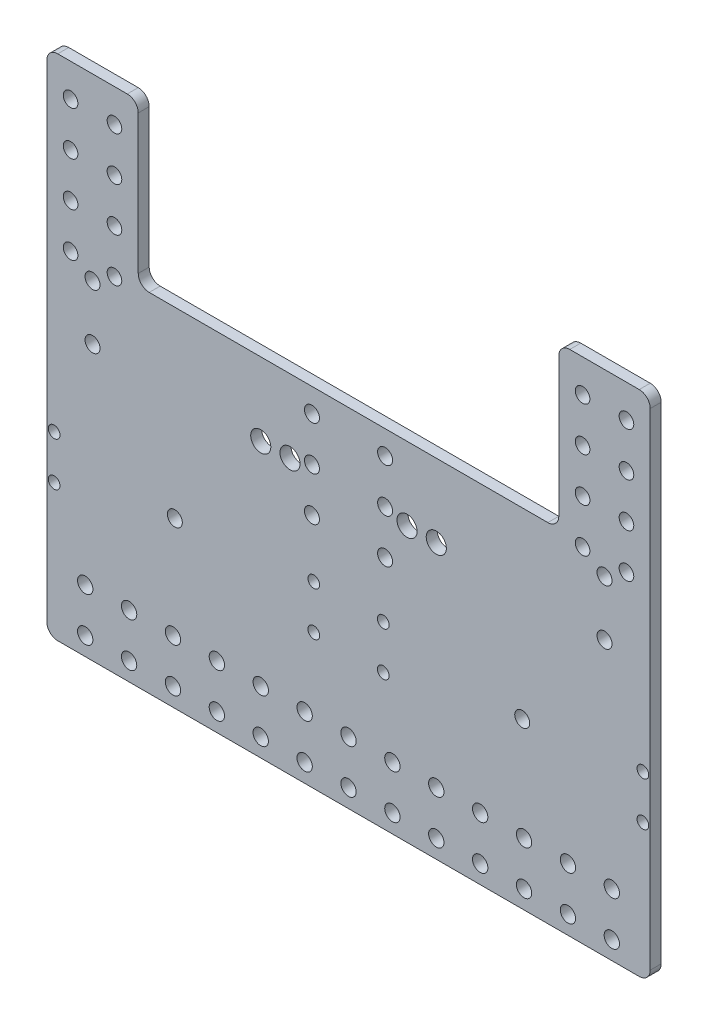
SolidWorks part; units mm, degrees
ref_plane "前视基准面" through (0, 0, 0) normal (0, 0, 1) x (1, 0, 0)
ref_plane "上视基准面" through (0, 0, 0) normal (0, 1, 0) x (1, 0, 0)
ref_plane "右视基准面" through (0, 0, 0) normal (1, 0, 0) x (0, 0, -1)
sketch "草图1" plane through (0, 0, 0) normal (0, 0, 1) x (1, 0, 0)
  line L0 (-421.3386, 0) -> (441.7259, 0) construction
  line L1 (0, 427.568) -> (0, -457.0164) construction
  line L2 (-70, 224.7956) -> (-70, 182.655) construction
  line L3 (-82.5, -215) -> (82.5, -215)
  line L4 (-82.5, -215) -> (-82.5, 215)
  line L5 (-82.5, 215) -> (82.5, 215)
  line L6 (82.5, -215) -> (82.5, 215)
  line L7 (-82.5, -215) -> (82.5, 215) construction
  line L8 (-82.5, 215) -> (82.5, -215) construction
  line L9 (-98.7333, 200) -> (-47.9143, 200) construction
  circle A0 centre (-70, 200) radius 2.05
  circle A1 centre (-70, 185) radius 2.05
  circle A2 centre (70, 185) radius 2.05
  circle A3 centre (70, 200) radius 2.05
  circle A4 centre (-70, -185) radius 2.05
  circle A5 centre (-70, -200) radius 2.05
  circle A6 centre (70, -200) radius 2.05
  circle A7 centre (70, -185) radius 2.05
  point P5 (0, 0)
  dimension "D5" = 4.1
  dimension "D6" = 4.1
  dimension "D7" = 15
  dimension "D1" = 165
  dimension "D2" = 430
  dimension "D3" = 15
  dimension "D4" = 12.5
  dimension "D8" = 0
extrude "凸台-拉伸1" add sketch "草图1" along normal blind 3
sketch "草图2" plane through (0, 0, 3) normal (0, 0, 1) x (1, 0, 0)
  line L0 (0, 347.0549) -> (0, -401.2293) construction
  line L1 (-360.8481, 0) -> (355.8343, 0) construction
  line L2 (-43.4458, -43.4458) -> (0, 0) construction
  circle A0 centre (0, 0) radius 29.5 construction
  circle A1 centre (-20.8597, -20.8597) radius 1.6
  circle A2 centre (-20.8597, 20.8597) radius 1.6
  circle A3 centre (20.8597, 20.8597) radius 1.6
  circle A4 centre (20.8597, -20.8597) radius 1.6
  point P19 (0, 0)
  dimension "D1" = 59
  dimension "D3" = 3.2
  dimension "D5" = 20.8597
  dimension "D6" = 20.8597
  dimension "D2" = 45
  dimension "D4" = 4
extrude "切除-拉伸1" cut sketch "草图2" against normal through all both and the other way through all
sketch "草图6" plane through (0, 0, 0) normal (0, 0, -1) x (-1, 0, 0)
  line L0 (-227.0694, 0) -> (202.0465, 0) construction
  line L1 (0, 619.2168) -> (0, -760.7029) construction
  line L2 (-82.5, -215) -> (-82.5, -285)
  line L3 (-82.5, 215) -> (82.5, 215)
  line L4 (-82.5, 215) -> (-82.5, -215)
  line L5 (-82.5, -215) -> (82.5, -215)
  line L6 (82.5, 215) -> (82.5, -215)
  line L7 (-160, 90) -> (160, 90)
  line L8 (-160, 90) -> (-160, -90)
  line L9 (-160, -90) -> (160, -90)
  line L10 (160, 90) -> (160, -90)
  line L11 (-160, 90) -> (160, -90) construction
  line L12 (-160, -90) -> (160, 90) construction
  line L13 (-82.5, -285) -> (-225, -285)
  line L14 (-225, -285) -> (-225, -325)
  line L15 (-225, -325) -> (225, -325)
  line L16 (225, -285) -> (225, -325)
  line L17 (82.5, -285) -> (225, -285)
  line L18 (82.5, -215) -> (82.5, -285)
  line L19 (-82.5, 215) -> (-82.5, 225)
  line L20 (-82.5, 225) -> (-200, 267)
  line L21 (-200, 267) -> (-200, 287)
  line L22 (-200, 287) -> (200, 287)
  line L23 (200, 267) -> (200, 287)
  line L24 (82.5, 225) -> (200, 267)
  line L25 (82.5, 215) -> (82.5, 225)
  point P11 (0, 0)
  point P21 (0, -325)
  point P28 (0, 287)
  dimension "D1" = 180
  dimension "D2" = 320
  dimension "D3" = 450
  dimension "D4" = 400
  dimension "D5" = 40
  dimension "D6" = 70
  dimension "D7" = 72
  dimension "D8" = 10
  dimension "D9" = 20
extrude "凸台-拉伸2" add sketch "草图6" against normal blind 3 contours L3 L25 L24 L23 L22 L21 L20 L19 | L8 L9 L4 L7 | L10 L7 L6 L9 | L18 L5 L2 L13 L14 L15 L16 L17
fillet "圆角1" radius 60 2 edges at (-82.5, -90, 1.5) (82.5, -90, 1.5)
fillet "圆角2" radius 20 2 edges at (82.5, 225, 1.5) (-82.5, 225, 1.5)
fillet "圆角3" radius 10 8 edges at (200, 267, 1.5) (-200, 267, 1.5) (-200, 287, 1.5) (200, 287, 1.5) (-225, -325, 1.5) (-225, -285, 1.5) (225, -325, 1.5) (225, -285, 1.5)
sketch "草图9" plane through (0, 0, 0) normal (0, 0, -1) x (-1, 0, 0)
  line L0 (0, 378.7393) -> (0, -366.1079) construction
  line L1 (453.619, 0) -> (-417.8729, 0) construction
  circle A0 centre (9, 169) radius 1.6
  circle A1 centre (-9, 169) radius 1.6
  circle A2 centre (-9, -169) radius 1.6
  circle A3 centre (9, -169) radius 1.6
  circle A4 centre (-119, 9) radius 1.6
  circle A5 centre (-119, -9) radius 1.6
  circle A6 centre (119, -9) radius 1.6
  circle A7 centre (119, 9) radius 1.6
  dimension "D1" = 3.2
  dimension "D2" = 9
  dimension "D3" = 338
  dimension "D4" = 3.2
  dimension "D5" = 9
  dimension "D6" = 119
extrude "切除-拉伸6" cut sketch "草图9" against normal through all both and the other way through all
sketch "草图10" plane through (0, 0, 0) normal (0, 0, -1) x (-1, 0, 0)
  line L0 (0, 401.4987) -> (0, -411.1621) construction
  line L1 (-190, 287) -> (190, 287) construction
  circle A0 centre (-32.5, 252) radius 1.6
  circle A1 centre (42.5, 252) radius 1.6
  circle A2 centre (-32.5, 230) radius 1.6
  circle A3 centre (42.5, 230) radius 1.6
  dimension "D1" = 3.2
  dimension "D2" = 35
  dimension "D3" = 32.5
  dimension "D5" = 32.5
  dimension "D6" = 22
  dimension "D4" = 2
  dimension "D7" = 2
extrude "切除-拉伸7" cut sketch "草图10" against normal through all both and the other way through all
sketch "草图11" plane through (0, 0, 0) normal (0, 0, -1) x (-1, 0, 0)
  line L0 (-240.8833, 0) -> (241.6194, 0) construction
  line L1 (-70, 400.9007) -> (-70, -322.8007) construction
  line L2 (-60, 13.8882) -> (-60, -20.7957) construction
  line L3 (0, -540.0334) -> (0, 534.218) construction
  line L4 (60, 13.8882) -> (60, -20.7957) construction
  circle A0 centre (-67.5, 7.5) radius 1.6
  circle A1 centre (-52.5, 7.5) radius 1.6
  circle A2 centre (-52.5, -7.5) radius 1.6
  circle A3 centre (-67.5, -7.5) radius 1.6
  circle A4 centre (67.5, -7.5) radius 1.6
  circle A5 centre (52.5, -7.5) radius 1.6
  circle A6 centre (52.5, 7.5) radius 1.6
  circle A7 centre (67.5, 7.5) radius 1.6
  dimension "D3" = 3.2
  dimension "D4" = 7.5
  dimension "D5" = 7.5
  dimension "D1" = 70
  dimension "D2" = 10
extrude "切除-拉伸8" cut sketch "草图11" against normal through all both and the other way through all
sketch "草图12" plane through (0, 0, 0) normal (0, 0, -1) x (-1, 0, 0)
  line L0 (-297.0189, 0) -> (244.4648, 0) construction
  line L1 (0, 398.3573) -> (0, -359.0878) construction
  line L2 (-160, 90) -> (-160, -90) construction
  circle A0 centre (-120, 35.79) radius 1.6
  circle A1 centre (-120, -35.79) radius 1.6
  circle A2 centre (-91.55, 35.79) radius 1.6
  circle A3 centre (-91.55, -35.79) radius 1.6
  dimension "D1" = 3.2
  dimension "D2" = 35.79
  dimension "D4" = 40
  dimension "D5" = 28.45
  dimension "D6" = 35.79
  dimension "D3" = 2
extrude "切除-拉伸9" [suppressed] cut sketch "草图12" against normal through all both and the other way through all
fillet "圆角4" radius 30 4 edges at (160, -90, 1.5) (160, 90, 1.5) (-160, -90, 1.5) (-160, 90, 1.5)
sketch "草图13" plane through (0, 0, 3) normal (0, 0, 1) x (1, 0, 0)
  line L0 (-277.8952, 0) -> (259.9137, 0) construction
  line L1 (0, 338.1615) -> (0, -323.8829) construction
  line L2 (0, 55) -> (0, 85) construction
  line L3 (-98.826, 70) -> (91.3151, 70) construction
  circle A0 centre (0, 70) radius 12.5
  circle A1 centre (9, 169) radius 1.6 construction
  circle A4 centre (-20, 70) radius 2.1
  circle A5 centre (20, 70) radius 2.1
  point P7 (0, 70)
  dimension "D6" = 25
  dimension "D7" = 99
  dimension "D8" = 4.2
  dimension "D9" = 20
  dimension "D3" = 70
extrude "切除-拉伸10" cut sketch "草图13" against normal through all both and the other way through all
sketch "草图14" plane through (0, 0, 3) normal (0, 0, 1) x (1, 0, 0)
  line L0 (0, 413.2292) -> (0, -453.9607) construction
  line L1 (-225.2126, 0) -> (210.9363, 0) construction
  line L2 (97.5, 10) -> (97.5, -10) construction
  line L3 (-82.5, 150) -> (82.5, 150) construction
  line L4 (-82.5, 150) -> (-82.5, -150) construction
  line L5 (-82.5, -150) -> (82.5, -150) construction
  line L6 (82.5, 150) -> (82.5, -150) construction
  line L7 (105.5, 10) -> (105.5, -10)
  line L8 (89.5, 10) -> (89.5, -10)
  line L9 (-97.5, 10) -> (-97.5, -10) construction
  line L10 (-105.5, 10) -> (-105.5, -10)
  line L11 (-89.5, 10) -> (-89.5, -10)
  arc A0 (105.5, 10) -> (89.5, 10) centre (97.5, 10) ccw
  arc A1 (89.5, -10) -> (105.5, -10) centre (97.5, -10) ccw
  arc A2 (-105.5, 10) -> (-89.5, 10) centre (-97.5, 10) cw
  arc A3 (-89.5, -10) -> (-105.5, -10) centre (-97.5, -10) cw
  point P13 (97.5, 0)
  point P20 (-97.5, 0)
  dimension "D1" = 8
  dimension "D2" = 20
  dimension "D3" = 15
extrude "切除-拉伸11" cut sketch "草图14" against normal through all both and the other way through all
sketch "草图15" plane through (0, 0, 3) normal (0, 0, 1) x (1, 0, 0)
  line L0 (0, 338.1615) -> (0, -332.0563) construction
  line L1 (-295.0593, 0) -> (246.8363, 0) construction
  line L2 (-160, 60) -> (-160, -60.8723) construction
  circle A0 centre (-140, 39.5) radius 1.6
  circle A1 centre (-98, 39.5) radius 1.6
  circle A2 centre (-98, -39.5) radius 1.6
  circle A3 centre (-140, -39.5) radius 1.6
  dimension "D1" = 3.2
  dimension "D2" = 39.5
  dimension "D4" = 20
  dimension "D5" = 39.5
  dimension "D6" = 42
  dimension "D3" = 2
extrude "切除-拉伸12" [suppressed] cut sketch "草图15" against normal through all both and the other way through all
sketch "草图16" plane through (0, 0, 3) normal (0, 0, 1) x (1, 0, 0)
  line L0 (0, 287) -> (0, 0) construction
  line L1 (190, 287) -> (-190, 287) construction
  line L2 (215, -325) -> (-215, -325) construction
  circle A0 centre (-45, -75) radius 1.55
  circle A1 centre (45, -75) radius 1.55
  circle A2 centre (45, -175) radius 1.55
  circle A3 centre (-45, -175) radius 1.55
  dimension "D1" = 3.1
  dimension "D2" = 90
  dimension "D3" = 2
  dimension "D5" = 150
  dimension "D4" = 2
extrude "切除-拉伸13" cut sketch "草图16" against normal blind 10
sketch "草图17" plane through (0, 0, 3) normal (0, 0, 1) x (1, 0, 0)
  line L0 (0, 287) -> (0, -367.0095) construction
  line L1 (190, 287) -> (-190, 287) construction
  line L2 (215, -325) -> (-215, -325) construction
  line L3 (-160, -0.4361) -> (160, -0.4361) construction
  line L4 (-160, 60) -> (-160, -60.8723) construction
  line L5 (160, 60) -> (160, -60.8723) construction
  circle A0 centre (-25, 217) radius 1.55
  circle A1 centre (25, 217) radius 1.55
  circle A2 centre (25, 167) radius 1.55
  circle A3 centre (-25, 167) radius 1.55
  circle A4 centre (-47.5, -265) radius 2.05
  circle A5 centre (47.5, -265) radius 2.05
  circle A6 centre (47.5, -240) radius 2.05
  circle A7 centre (-47.5, -240) radius 2.05
  circle A8 centre (-150, 47.0639) radius 2.05
  circle A9 centre (-125, 47.0639) radius 2.05
  circle A10 centre (-125, -47.9361) radius 2.05
  circle A11 centre (-150, -47.9361) radius 2.05
  circle A12 centre (125, -47.9361) radius 2.05
  circle A13 centre (150, -47.9361) radius 2.05
  circle A14 centre (150, 47.0639) radius 2.05
  circle A15 centre (125, 47.0639) radius 2.05
  circle A16 centre (-70, 185) radius 2.05 construction
  circle A18 centre (70, 175) radius 2.05
  circle A19 centre (70, 160) radius 2.05
  circle A20 centre (-70, 160) radius 2.05
  circle A21 centre (-70, 175) radius 2.05
  dimension "D1" = 3.1
  dimension "D2" = 70
  dimension "D3" = 50
  dimension "D4" = 2
  dimension "D6" = 4.1
  dimension "D7" = 95
  dimension "D8" = 60
  dimension "D9" = 2
  dimension "D11" = 95
  dimension "D12" = 4.1
  dimension "D13" = 10
  dimension "D16" = 0
  dimension "D17" = 0
  dimension "D5" = 2
  dimension "D10" = 2
  dimension "D14" = 2
  dimension "D15" = 2
extrude "切除-拉伸14" cut sketch "草图17" against normal blind 10
sketch "草图18" plane through (0, 0, 3) normal (0, 0, 1) x (1, 0, 0)
  line L0 (0, -325) -> (0, 0) construction
  line L1 (215, -325) -> (-215, -325) construction
  line L2 (-100, -325) -> (100, -325)
  line L3 (100, -325) -> (71.1325, -275)
  line L4 (71.1325, -275) -> (-71.1325, -275)
  line L5 (-100, -325) -> (-71.1325, -275)
  point P10 (0, -275)
  dimension "D1" = 200
  dimension "D2" = 50
  dimension "D3" = 60
extrude "切除-拉伸15" cut sketch "草图18" against normal blind 10
fillet "圆角5" radius 20 4 edges at (100, -325, 1.5) (71.1325, -275, 1.5) (-71.1325, -275, 1.5) (-100, -325, 1.5)
fillet "圆角6" radius 80 2 edges at (-82.5, -285, 1.5) (82.5, -285, 1.5)
sketch "草图19" plane through (0, 0, 3) normal (0, 0, 1) x (1, 0, 0)
  line L0 (0, 70) -> (0, -24.3383) construction
  line L1 (160, 60) -> (160, -60.8723) construction
  circle A0 centre (51.8, -12.8) radius 1.35
  circle A1 centre (0, 70) radius 12.5 construction
  circle A2 centre (-51.8, -12.8) radius 1.35
  circle A3 centre (-51.8, 90.8) radius 1.35
  circle A4 centre (51.8, 90.8) radius 1.35
  dimension "D1" = 2.7
  dimension "D2" = 82.8
  dimension "D3" = 108.2
  dimension "D4" = 2
  dimension "D5" = 2
extrude "切除-拉伸17" cut sketch "草图19" against normal blind 64
sketch "草图20" plane through (0, 0, 0) normal (0, 0, -1) x (-1, 0, 0)
  line L0 (0, 0) -> (0, -311.1921) construction
  line L1 (59.5855, -275) -> (-59.5855, -275) construction
  line L2 (-75, 35) -> (75, 35)
  line L3 (-75, 35) -> (-75, -65)
  line L4 (-75, -65) -> (75, -65)
  line L5 (75, 35) -> (75, -65)
  line L6 (-75, 35) -> (75, -65) construction
  line L7 (-75, -65) -> (75, 35) construction
  point P3 (0, -15)
  dimension "D1" = 150
  dimension "D2" = 210
  dimension "D3" = 100
extrude "切除-拉伸18" cut sketch "草图20" against normal blind 64
sketch "草图21" plane through (0, 0, 0) normal (0, 0, -1) x (-1, 0, 0)
  line L0 (-134.1892, -192) -> (163.3118, -192) construction
  line L1 (0, -275) -> (0, -184.8859) construction
  line L2 (59.5855, -275) -> (-59.5855, -275) construction
  line L6 (-68.3759, -202.5) -> (66.2302, -202.5) construction
  circle A2 centre (-10, -196.5) radius 2.05
  circle A3 centre (10, -196.5) radius 2.05
  circle A4 centre (10, -208.5) radius 2.05
  circle A5 centre (-10, -208.5) radius 2.05
  dimension "D2" = 10
  dimension "D6" = 4.1
  dimension "D7" = 20
  dimension "D8" = 12
  dimension "D9" = 2
  dimension "D4" = 83
  dimension "D10" = 2
extrude "切除-拉伸19" cut sketch "草图21" against normal blind 10
sketch "草图22" plane through (0, 0, 3) normal (0, 0, 1) x (1, 0, 0)
  line L0 (-82.5, 215.5) -> (82.5, 215.5) construction
  line L1 (-82.5, 210.9096) -> (-82.5, 90) construction
  line L2 (82.5, 90) -> (82.5, 210.9096) construction
  line L3 (-70, 200) -> (-70, 232.5781) construction
  line L4 (0, 287) -> (0, 0) construction
  line L5 (190, 287) -> (-190, 287) construction
  circle A0 centre (-70, 200) radius 2.05 construction
  circle A1 centre (-76, 209) radius 2.05
  circle A2 centre (-64, 209) radius 2.05
  circle A3 centre (76, 209) radius 2.05
  circle A4 centre (64, 209) radius 2.05
  circle A5 centre (-76, 197) radius 2.05
  circle A6 centre (-64, 197) radius 2.05
  circle A7 centre (64, 197) radius 2.05
  circle A8 centre (76, 197) radius 2.05
  circle A9 centre (-76, 185) radius 2.05
  circle A10 centre (-64, 185) radius 2.05
  circle A11 centre (64, 185) radius 2.05
  circle A12 centre (76, 185) radius 2.05
  circle A13 centre (-76, 173) radius 2.05
  circle A14 centre (-64, 173) radius 2.05
  circle A15 centre (64, 173) radius 2.05
  circle A16 centre (76, 173) radius 2.05
  circle A17 centre (-76, 161) radius 2.05
  circle A18 centre (-64, 161) radius 2.05
  circle A19 centre (64, 161) radius 2.05
  circle A20 centre (76, 161) radius 2.05
  circle A21 centre (-76, 149) radius 2.05
  circle A22 centre (-64, 149) radius 2.05
  circle A23 centre (64, 149) radius 2.05
  circle A24 centre (76, 149) radius 2.05
  circle A25 centre (-76, 137) radius 2.05
  circle A26 centre (-64, 137) radius 2.05
  circle A27 centre (64, 137) radius 2.05
  circle A28 centre (76, 137) radius 2.05
  circle A29 centre (-76, 125) radius 2.05
  circle A30 centre (-64, 125) radius 2.05
  circle A31 centre (64, 125) radius 2.05
  circle A32 centre (76, 125) radius 2.05
  dimension "D1" = 15.5
  dimension "D2" = 4.1
  dimension "D3" = 6.5
  dimension "D4" = 12
  dimension "D5" = 8
extrude "切除-拉伸20" cut sketch "草图22" against normal blind 10
sketch "草图23" plane through (0, 0, 3) normal (0, 0, 1) x (1, 0, 0)
  circle A0 centre (70, 200) radius 2.05 construction
  circle A1 centre (70, 185) radius 2.05 construction
  circle A2 centre (70, 175) radius 2.05 construction
  circle A3 centre (70, 160) radius 2.05 construction
  circle A4 centre (-70, 160) radius 2.05 construction
  circle A5 centre (-70, 175) radius 2.05 construction
  circle A6 centre (-70, 185) radius 2.05 construction
  circle A7 centre (-70, 200) radius 2.05 construction
  circle A8 centre (70, 200) radius 2.05
  circle A9 centre (70, 185) radius 2.05
  circle A10 centre (70, 175) radius 2.05
  circle A11 centre (70, 160) radius 2.05
  circle A12 centre (-70, 160) radius 2.05
  circle A13 centre (-70, 175) radius 2.05
  circle A14 centre (-70, 185) radius 2.05
  circle A15 centre (-70, 200) radius 2.05
extrude "凸台-拉伸3" add sketch "草图23" against normal up to surface (3 mm away)
sketch "草图24" plane through (0, 0, 3) normal (0, 0, 1) x (1, 0, 0)
  line L1 (-252.7518, -171) -> (259.7403, -171)
  line L2 (-252.7518, -171) -> (-252.7518, 350.8101)
  line L3 (-252.7518, 350.8101) -> (259.7403, 350.8101)
  line L4 (259.7403, -171) -> (259.7403, 350.8101)
  circle A0 centre (70, -185) radius 2.05 construction
  dimension "D1" = 14
extrude "切除-拉伸21" cut sketch "草图24" against normal blind 10
sketch "草图25" plane through (0, 0, 3) normal (0, 0, 1) x (1, 0, 0)
  line L0 (-134.6436, -215.5) -> (167.602, -215.5) construction
  line L1 (-82.5, -171) -> (82.5, -171) construction
  line L2 (0, -171) -> (0, -275) construction
  line L3 (59.5855, -275) -> (-59.5855, -275) construction
  circle A0 centre (-10, -220.5) radius 2.05
  circle A1 centre (10, -220.5) radius 2.05
  dimension "D2" = 4.1
  dimension "D3" = 5
  dimension "D4" = 20
  dimension "D1" = 44.5
extrude "切除-拉伸22" cut sketch "草图25" against normal blind 10
sketch "草图28" plane through (0, 0, 0) normal (0, 0, -1) x (-1, 0, 0)
  line L0 (-225, -231) -> (225, -231) construction
  line L3 (0, -275) -> (0, -380.2837) construction
  line L4 (59.5855, -275) -> (-59.5855, -275) construction
  line L6 (-82.5, -171) -> (82.5, -171) construction
  circle A0 centre (-75, -231) radius 1.55
  circle A1 centre (-65, -231) radius 1.55
  circle A2 centre (75, -231) radius 1.55
  circle A3 centre (65, -231) radius 1.55
  dimension "D1" = 3.1
  dimension "D2" = 3.1
  dimension "D3" = 65
  dimension "D4" = 10
  dimension "D5" = 60
extrude "切除-拉伸24" cut sketch "草图28" against normal blind 10
sketch "草图30" plane through (0, 0, 0) normal (0, 0, -1) x (-1, 0, 0)
  line L0 (82.5, -171) -> (82.5, -205) construction
  line L1 (-82.5, -171) -> (82.5, -171)
  line L2 (-82.5, -171) -> (-82.5, -275)
  line L3 (-82.5, -275) -> (82.5, -275)
  line L4 (82.5, -171) -> (82.5, -275)
  line L5 (59.5855, -275) -> (-59.5855, -275) construction
  line L7 (-320.1129, -81.2496) -> (306.5216, -81.2496)
  line L8 (-320.1129, -81.2496) -> (-320.1129, -451.5336)
  line L9 (-320.1129, -451.5336) -> (306.5216, -451.5336)
  line L10 (306.5216, -81.2496) -> (306.5216, -451.5336)
  dimension "D1" = 0
  dimension "D2" = 0
extrude "切除-拉伸26" cut sketch "草图30" against normal blind 10
sketch "草图31" plane through (0, 0, 0) normal (0, 0, -1) x (-1, 0, 0)
  line L0 (0, -275) -> (0, -171) construction
  line L1 (82.5, -275) -> (-82.5, -275) construction
  line L2 (-82.5, -171) -> (82.5, -171) construction
  line L3 (-82.5, -275) -> (-82.5, -171) construction
  circle A0 centre (-76.5, -269) radius 2.1
  circle A1 centre (-64.5, -269) radius 2.1
  circle A2 centre (-64.5, -259) radius 2.1
  circle A3 centre (-76.5, -259) radius 2.1
  circle A4 centre (-28.5, -269) radius 2.1
  circle A5 centre (-16.5, -269) radius 2.1
  circle A6 centre (-16.5, -259) radius 2.1
  circle A7 centre (-28.5, -259) radius 2.1
  circle A8 centre (76.5, -259) radius 2.1
  circle A9 centre (64.5, -259) radius 2.1
  circle A10 centre (64.5, -269) radius 2.1
  circle A11 centre (76.5, -269) radius 2.1
  circle A12 centre (28.5, -259) radius 2.1
  circle A13 centre (16.5, -259) radius 2.1
  circle A14 centre (16.5, -269) radius 2.1
  circle A15 centre (28.5, -269) radius 2.1
  dimension "D1" = 4.2
  dimension "D2" = 6
  dimension "D3" = 6
  dimension "D4" = 2
  dimension "D5" = 2
  dimension "D6" = 2
extrude "切除-拉伸27" cut sketch "草图31" against normal blind 10
sketch "草图32" plane through (0, 0, 3) normal (0, 0, 1) x (1, 0, 0)
  line L0 (82.5, -275) -> (82.5, -171) construction
  line L1 (-82.5, -275) -> (82.5, -275)
  line L2 (-82.5, -275) -> (-82.5, -255)
  line L3 (-82.5, -255) -> (82.5, -255)
  line L4 (82.5, -275) -> (82.5, -255)
  dimension "D1" = 20
extrude "切除-拉伸28" cut sketch "草图32" against normal blind 10
sketch "草图33" plane through (0, 0, 3) normal (0, 0, 1) x (1, 0, 0)
  line L1 (-82.5, -171) -> (-57.5, -171)
  line L2 (-82.5, -171) -> (-82.5, -146)
  line L3 (-82.5, -146) -> (-57.5, -146)
  line L4 (-57.5, -171) -> (-57.5, -146)
  line L5 (82.5, -171) -> (57.5, -171)
  line L6 (82.5, -171) -> (82.5, -146)
  line L7 (82.5, -146) -> (57.5, -146)
  line L8 (57.5, -171) -> (57.5, -146)
  dimension "D1" = 25
  dimension "D2" = 25
  dimension "D3" = 25
  dimension "D4" = 25
extrude "凸台-拉伸4" add sketch "草图33" against normal up to surface (3 mm away)
sketch "草图34" plane through (0, 0, 3) normal (0, 0, 1) x (1, 0, 0)
  line L0 (-70, -146) -> (-70, -211.1883) construction
  line L1 (-57.5, -146) -> (-82.5, -146) construction
  line L2 (70, -146) -> (70, -214.5341) construction
  line L3 (82.5, -146) -> (57.5, -146) construction
  line L4 (0, -171) -> (0, -145.4586) construction
  line L5 (-57.5, -171) -> (57.5, -171) construction
  line L6 (70, -146) -> (70, -211.1883) construction
  line L7 (70, -158) -> (70, -226.5341) construction
  line L8 (70, -158) -> (70, -223.1883) construction
  line L9 (-70, -158) -> (-70, -223.1883) construction
  line L10 (70, -170) -> (70, -238.5341) construction
  line L11 (70, -170) -> (70, -235.1883) construction
  line L12 (-70, -170) -> (-70, -235.1883) construction
  line L13 (70, -182) -> (70, -250.5341) construction
  line L14 (70, -182) -> (70, -247.1883) construction
  line L15 (-70, -182) -> (-70, -247.1883) construction
  circle A0 centre (-76, -155) radius 2
  circle A1 centre (-64, -155) radius 2
  circle A2 centre (64, -155) radius 2
  circle A3 centre (76, -155) radius 2
  circle A4 centre (64, -167) radius 2
  circle A5 centre (76, -167) radius 2
  circle A6 centre (-76, -167) radius 2
  circle A7 centre (-64, -167) radius 2
  circle A8 centre (64, -179) radius 2
  circle A9 centre (76, -179) radius 2
  circle A10 centre (-76, -179) radius 2
  circle A11 centre (-64, -179) radius 2
  circle A12 centre (64, -191) radius 2
  circle A13 centre (76, -191) radius 2
  circle A14 centre (-76, -191) radius 2
  circle A15 centre (-64, -191) radius 2
  dimension "D1" = 4
  dimension "D2" = 4
  dimension "D3" = 9
  dimension "D4" = 9
  dimension "D5" = 6
  dimension "D6" = 6
  dimension "D7" = 4
extrude "切除-拉伸29" cut sketch "草图34" against normal blind 10
sketch "草图41" plane through (0, 0, 3) normal (0, 0, 1) x (1, 0, 0)
  circle A0 centre (-24, -210) radius 2.75
  circle A1 centre (-16, -210) radius 2.75
  circle A2 centre (16, -210) radius 2.75
  circle A3 centre (24, -210) radius 2.75
extrude "切除-拉伸30" cut sketch "草图41" against normal up to surface (3 mm away)
sketch "草图42" plane through (0, 0, 3) normal (0, 0, 1) x (1, 0, 0)
  line L0 (82.5, -255) -> (-82.5, -255) construction
  line L1 (-37.5, -203) -> (37.5, -203)
  line L2 (-37.5, -203) -> (-37.5, -218)
  line L3 (-37.5, -218) -> (37.5, -218)
  line L4 (37.5, -203) -> (37.5, -218)
  line L5 (-82.5, -146) -> (-82.5, -255) construction
  circle A0 centre (24, -210) radius 2.75 construction
  circle A1 centre (16, -210) radius 2.75 construction
  circle A2 centre (-16, -210) radius 2.75 construction
  circle A3 centre (-24, -210) radius 2.75 construction
  circle A4 centre (24, -210) radius 2.75
  circle A5 centre (16, -210) radius 2.75
  circle A6 centre (-16, -210) radius 2.75
  circle A7 centre (-24, -210) radius 2.75
  circle A8 centre (10, -208.5) radius 2.05 construction
  circle A9 centre (-10, -208.5) radius 2.05 construction
  circle A10 centre (10, -208.5) radius 2.05
  circle A11 centre (-10, -208.5) radius 2.05
  dimension "D1" = 15
  dimension "D2" = 37
  dimension "D3" = 45
  dimension "D4" = 75
extrude "凸台-拉伸5" [suppressed] add sketch "草图42" along normal blind 5
sketch "草图43" plane through (0, -255, 0) normal (0, -1, 0) x (1, 0, 0)
  line L1 (-82.5, 0) -> (82.5, 0)
  line L2 (-82.5, 0) -> (-82.5, 3)
  line L3 (-82.5, 3) -> (82.5, 3)
  line L4 (82.5, 0) -> (82.5, 3)
extrude "切除-拉伸31" [suppressed] cut sketch "草图43" against normal blind 165
sketch "草图44" plane through (0, 0, 3) normal (0, 0, 1) x (1, 0, 0)
  line L0 (-57.5, -171) -> (-57.5, -146) construction
  line L1 (-82.5, -146) -> (-57.5, -146)
  line L2 (-82.5, -146) -> (-82.5, -164.0335)
  line L3 (-82.5, -164.0335) -> (-57.5, -164.0335)
  line L4 (-57.5, -146) -> (-57.5, -164.0335)
  line L6 (-110.2707, -128.6871) -> (118.485, -128.6871)
  line L7 (-110.2707, -128.6871) -> (-110.2707, -271.5661)
  line L8 (-110.2707, -271.5661) -> (118.485, -271.5661)
  line L9 (118.485, -128.6871) -> (118.485, -271.5661)
extrude "切除-拉伸32" [suppressed] cut sketch "草图44" against normal blind 1
sketch "草图46" [suppressed] plane through (0, -255, 0) normal (0, -1, 0) x (1, 0, 0)
  line L1 (-82.5, 0) -> (82.5, 0)
  line L2 (-82.5, 0) -> (-82.5, 2)
  line L3 (-82.5, 2) -> (82.5, 2)
  line L4 (82.5, 0) -> (82.5, 2)
extrude "切除-拉伸33" [suppressed] cut sketch "草图46" against normal up to surface (109 mm away)
sketch "草图47" plane through (0, 0, 3) normal (0, 0, 1) x (1, 0, 0)
  line L1 (-82.5, -255) -> (82.5, -255)
  line L2 (-82.5, -255) -> (-82.5, -285)
  line L3 (-82.5, -285) -> (82.5, -285)
  line L4 (82.5, -255) -> (82.5, -285)
  circle A0 centre (-72, -280) radius 2.1
  circle A1 centre (-60, -280) radius 2.1
  circle A2 centre (-48, -280) radius 2.1
  circle A3 centre (-36, -280) radius 2.1
  circle A4 centre (-24, -280) radius 2.1
  circle A5 centre (-12, -280) radius 2.1
  circle A6 centre (0, -280) radius 2.1
  circle A7 centre (12, -280) radius 2.1
  circle A8 centre (24, -280) radius 2.1
  circle A9 centre (36, -280) radius 2.1
  circle A10 centre (48, -280) radius 2.1
  circle A11 centre (60, -280) radius 2.1
  circle A12 centre (72, -280) radius 2.1
  circle A13 centre (-60, -268) radius 2.1
  circle A14 centre (-48, -268) radius 2.1
  circle A15 centre (-36, -268) radius 2.1
  circle A16 centre (-24, -268) radius 2.1
  circle A17 centre (-12, -268) radius 2.1
  circle A18 centre (0, -268) radius 2.1
  circle A19 centre (12, -268) radius 2.1
  circle A20 centre (24, -268) radius 2.1
  circle A21 centre (36, -268) radius 2.1
  circle A22 centre (48, -268) radius 2.1
  circle A23 centre (60, -268) radius 2.1
  circle A24 centre (72, -268) radius 2.1
  circle A25 centre (-72, -268) radius 2.1
  dimension "D2" = 4.2
  dimension "D3" = 5
  dimension "D4" = 10.5
  dimension "D1" = 30
  dimension "D5" = 13
  dimension "D6" = 2
extrude "凸台-拉伸7" add sketch "草图47" against normal blind 3
sketch "草图49" plane through (0, 0, 0) normal (0, 0, -1) x (-1, 0, 0)
  circle A0 centre (70, -185) radius 2.05 construction
  circle A1 centre (70, -200) radius 2.05 construction
  circle A2 centre (-70, -200) radius 2.05 construction
  circle A3 centre (-70, -185) radius 2.05 construction
  circle A4 centre (70, -185) radius 2.05 construction
  circle A5 centre (70, -200) radius 2.05 construction
  circle A6 centre (-70, -200) radius 2.05 construction
  circle A7 centre (-70, -185) radius 2.05 construction
  circle A8 centre (70, -195) radius 2.05
  circle A9 centre (70, -210) radius 2.05
  circle A10 centre (-70, -210) radius 2.05
  circle A11 centre (-70, -195) radius 2.05
  dimension "D1" = 2
extrude "切除-拉伸34" cut sketch "草图49" against normal blind 10
sketch "草图50" plane through (0, 0, 0) normal (0, 0, -1) x (-1, 0, 0)
  circle A0 centre (70, -200) radius 2.05 construction
  circle A1 centre (70, -185) radius 2.05 construction
  circle A2 centre (-70, -200) radius 2.05 construction
  circle A3 centre (-70, -185) radius 2.05 construction
  circle A4 centre (70, -200) radius 2.05
  circle A5 centre (70, -185) radius 2.05
  circle A6 centre (-70, -200) radius 2.05
  circle A7 centre (-70, -185) radius 2.05
extrude "凸台-拉伸8" add sketch "草图50" against normal blind 3
sketch "草图51" plane through (0, 0, 0) normal (0, 0, -1) x (-1, 0, 0)
  line L1 (-57.5, -171) -> (57.5, -171)
  line L2 (-57.5, -171) -> (-57.5, -190)
  line L3 (-57.5, -190) -> (57.5, -190)
  line L4 (57.5, -171) -> (57.5, -190)
  dimension "D1" = 115
  dimension "D2" = 19
extrude "切除-拉伸35" cut sketch "草图51" against normal blind 10
fillet "圆角7" radius 3 8 edges at (-82.5, -285, 1.5) (82.5, -285, 1.5) (-82.5, -146, 1.5) (-57.5, -146, 1.5) (-57.5, -190, 1.5) (57.5, -190, 1.5) (57.5, -146, 1.5) (82.5, -146, 1.5)
sketch "草图53" plane through (0, 0, 0) normal (0, 0, -1) x (-1, 0, 0)
  circle A0 centre (75, -231) radius 1.55 construction
  circle A1 centre (65, -231) radius 1.55 construction
  circle A2 centre (-65, -231) radius 1.55 construction
  circle A3 centre (-75, -231) radius 1.55 construction
  circle A4 centre (75, -231) radius 1.55
  circle A5 centre (65, -231) radius 1.55
  circle A6 centre (-65, -231) radius 1.55
  circle A7 centre (-75, -231) radius 1.55
extrude "凸台-拉伸9" add sketch "草图53" against normal blind 3
sketch "草图52" plane through (0, 0, 0) normal (0, 0, -1) x (-1, 0, 0)
  line L0 (-82.5, -215) -> (82.5, -215) construction
  line L1 (-82.5, -282) -> (-82.5, -149) construction
  line L2 (82.5, -149) -> (82.5, -282) construction
  line L3 (79.5, -285) -> (-79.5, -285) construction
  line L4 (-96.7349, -242) -> (103.9917, -242) construction
  line L5 (0, -190) -> (0, -285) construction
  line L6 (-54.5, -190) -> (54.5, -190) construction
  circle A0 centre (-80.5, -236) radius 1.6
  circle A1 centre (-9.5, -236) radius 1.6
  circle A2 centre (-9.5, -248) radius 1.6
  circle A3 centre (-80.5, -248) radius 1.6
  circle A4 centre (9.5, -248) radius 1.6
  circle A5 centre (80.5, -248) radius 1.6
  circle A6 centre (9.5, -236) radius 1.6
  circle A7 centre (80.5, -236) radius 1.6
  dimension "D3" = 3.2
  dimension "D4" = 2
  dimension "D5" = 12
  dimension "D6" = 2
  dimension "D1" = 70
  dimension "D2" = 27
  dimension "D7" = 2
extrude "切除-拉伸36" cut sketch "草图52" against normal blind 3
